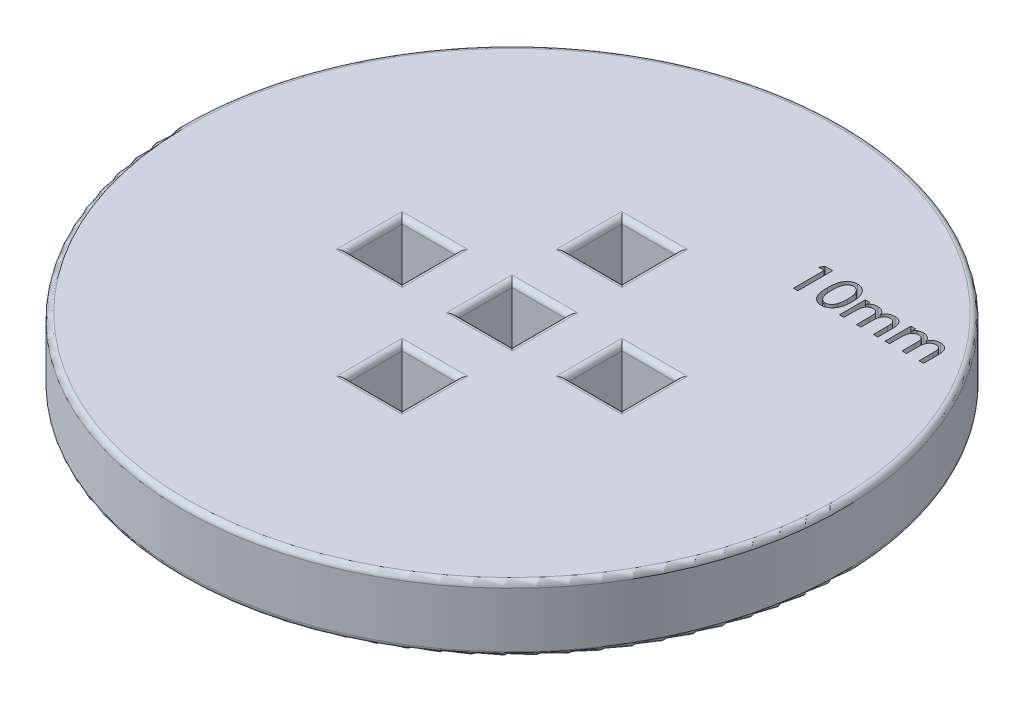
SolidWorks part; units mm, degrees
ref_plane "Front Plane" through (0, 0, 0) normal (0, 0, 1) x (1, 0, 0)
ref_plane "Top Plane" through (0, 0, 0) normal (0, 1, 0) x (1, 0, 0)
ref_plane "Right Plane" through (0, 0, 0) normal (1, 0, 0) x (0, 0, -1)
sketch "Sketch1" plane through (0, 0, 0) normal (0, 1, 0) x (1, 0, 0)
  circle A0 centre (0, 0) radius 30
extrude "Boss-Extrude1" add sketch "Sketch1" along normal blind 6
sketch "Sketch2" plane through (0, 6, 0) normal (0, 1, 0) x (1, 0, 0)
  line L0 (0, 0) -> (0, -10) construction
  line L1 (0, 0) -> (10, 0) construction
  line L2 (0, 0) -> (-10, 0) construction
  line L3 (0, 0) -> (0, 10) construction
  line L5 (-2.5, -7.5) -> (2.5, -7.5)
  line L6 (-2.5, -7.5) -> (-2.5, -12.5)
  line L7 (-2.5, -12.5) -> (2.5, -12.5)
  line L8 (2.5, -7.5) -> (2.5, -12.5)
  line L9 (-2.5, -7.5) -> (2.5, -12.5) construction
  line L10 (-2.5, -12.5) -> (2.5, -7.5) construction
  line L11 (-7.5, -2.5) -> (-12.5, -2.5)
  line L12 (-7.5, -2.5) -> (-7.5, 2.5)
  line L13 (-7.5, 2.5) -> (-12.5, 2.5)
  line L14 (-12.5, -2.5) -> (-12.5, 2.5)
  line L15 (-7.5, -2.5) -> (-12.5, 2.5) construction
  line L16 (-7.5, 2.5) -> (-12.5, -2.5) construction
  line L17 (2.5, -2.5) -> (-2.5, -2.5)
  line L18 (2.5, -2.5) -> (2.5, 2.5)
  line L19 (2.5, 2.5) -> (-2.5, 2.5)
  line L20 (-2.5, -2.5) -> (-2.5, 2.5)
  line L21 (2.5, -2.5) -> (-2.5, 2.5) construction
  line L22 (2.5, 2.5) -> (-2.5, -2.5) construction
  line L23 (-2.5, 12.5) -> (2.5, 12.5)
  line L24 (-2.5, 12.5) -> (-2.5, 7.5)
  line L25 (-2.5, 7.5) -> (2.5, 7.5)
  line L26 (2.5, 12.5) -> (2.5, 7.5)
  line L27 (-2.5, 12.5) -> (2.5, 7.5) construction
  line L28 (-2.5, 7.5) -> (2.5, 12.5) construction
  line L29 (12.5, -2.5) -> (7.5, -2.5)
  line L30 (12.5, -2.5) -> (12.5, 2.5)
  line L31 (12.5, 2.5) -> (7.5, 2.5)
  line L32 (7.5, -2.5) -> (7.5, 2.5)
  line L33 (12.5, -2.5) -> (7.5, 2.5) construction
  line L34 (12.5, 2.5) -> (7.5, -2.5) construction
  dimension "D1" = 5
  dimension "D2" = 10
  dimension "D3" = 5
  dimension "D4" = 5
  dimension "D5" = 5
  dimension "D6" = 5
  dimension "D7" = 5
  dimension "D8" = 5
extrude "Cut-Extrude1" cut sketch "Sketch2" against normal blind 3
fillet "Fillet1" radius 0.5 6 edges at (2.5, 6, 0) (0, 6, 2.5) (-12.5, 6, 0) (-10, 6, 2.5) (-7.5, 6, 0) (-10, 6, -2.5)
sketch "Sketch3" plane through (0, 6, 0) normal (0, 1, 0) x (1, 0, 0)
sketch "Sketch4" plane through (0, 0, 0) normal (0, -1, 0) x (-1, 0, 0)
  line L0 (0, 0) -> (-10, 0) construction
  line L1 (0, 0) -> (0, -10) construction
  line L2 (0, 0) -> (0, 10) construction
  line L3 (0, 0) -> (10, 0) construction
  line L5 (-2.5, 2.5) -> (2.5, 2.5)
  line L6 (-2.5, 2.5) -> (-2.5, -2.5)
  line L7 (-2.5, -2.5) -> (2.5, -2.5)
  line L8 (2.5, 2.5) -> (2.5, -2.5)
  line L9 (-2.5, 2.5) -> (2.5, -2.5) construction
  line L10 (-2.5, -2.5) -> (2.5, 2.5) construction
  line L11 (-2.5, -7.5) -> (2.5, -7.5)
  line L12 (-2.5, -7.5) -> (-2.5, -12.5)
  line L13 (-2.5, -12.5) -> (2.5, -12.5)
  line L14 (2.5, -7.5) -> (2.5, -12.5)
  line L15 (-2.5, -7.5) -> (2.5, -12.5) construction
  line L16 (-2.5, -12.5) -> (2.5, -7.5) construction
  line L17 (7.5, 2.5) -> (12.5, 2.5)
  line L18 (7.5, 2.5) -> (7.5, -2.5)
  line L19 (7.5, -2.5) -> (12.5, -2.5)
  line L20 (12.5, 2.5) -> (12.5, -2.5)
  line L21 (7.5, 2.5) -> (12.5, -2.5) construction
  line L22 (7.5, -2.5) -> (12.5, 2.5) construction
  line L23 (-12.5, 2.5) -> (-7.5, 2.5)
  line L24 (-12.5, 2.5) -> (-12.5, -2.5)
  line L25 (-12.5, -2.5) -> (-7.5, -2.5)
  line L26 (-7.5, 2.5) -> (-7.5, -2.5)
  line L27 (-12.5, 2.5) -> (-7.5, -2.5) construction
  line L28 (-12.5, -2.5) -> (-7.5, 2.5) construction
  line L29 (2.5, 7.5) -> (-2.5, 7.5)
  line L30 (2.5, 7.5) -> (2.5, 12.5)
  line L31 (2.5, 12.5) -> (-2.5, 12.5)
  line L32 (-2.5, 7.5) -> (-2.5, 12.5)
  line L33 (2.5, 7.5) -> (-2.5, 12.5) construction
  line L34 (2.5, 12.5) -> (-2.5, 7.5) construction
  dimension "D1" = 5
  dimension "D2" = 5
  dimension "D3" = 5
  dimension "D4" = 5
  dimension "D5" = 5
  dimension "D6" = 5
extrude "Cut-Extrude2" cut sketch "Sketch4" against normal blind 3
fillet "Fillet2" radius 0.5 21 edges at (0, 0, 30) (2.5, 0, 0) (0, 0, 2.5) (-2.5, 0, 0) (0, 0, -2.5) (2.5, 0, 10) (0, 0, 12.5) (-2.5, 0, 10) (0, 0, 7.5) (-7.5, 0, 0) (-10, 0, 2.5) (-12.5, 0, 0) (-10, 0, -2.5) (12.5, 0, 0) (10, 0, 2.5) (7.5, 0, 0) (10, 0, -2.5) (-2.5, 0, -10) (0, 0, -12.5) (2.5, 0, -10) (0, 0, -7.5)
fillet "Fillet3" radius 0.5 15 edges at (0, 6, 30) (0, 6, 7.5) (-2.5, 6, 10) (0, 6, 12.5) (2.5, 6, 10) (-2.5, 6, 0.25) (0.25, 6, -2.5) (0, 6, -12.5) (-2.5, 6, -10) (0, 6, -7.5) (2.5, 6, -10) (10, 6, 2.5) (12.5, 6, 0) (10, 6, -2.5) (7.5, 6, 0)
sketch "Sketch5" plane through (0, 6, 0) normal (0, 1, 0) x (1, 0, 0)
  text T0 "<b>10mm</b>"
extrude "Cut-Extrude3" cut sketch "Sketch5" against normal blind 3
